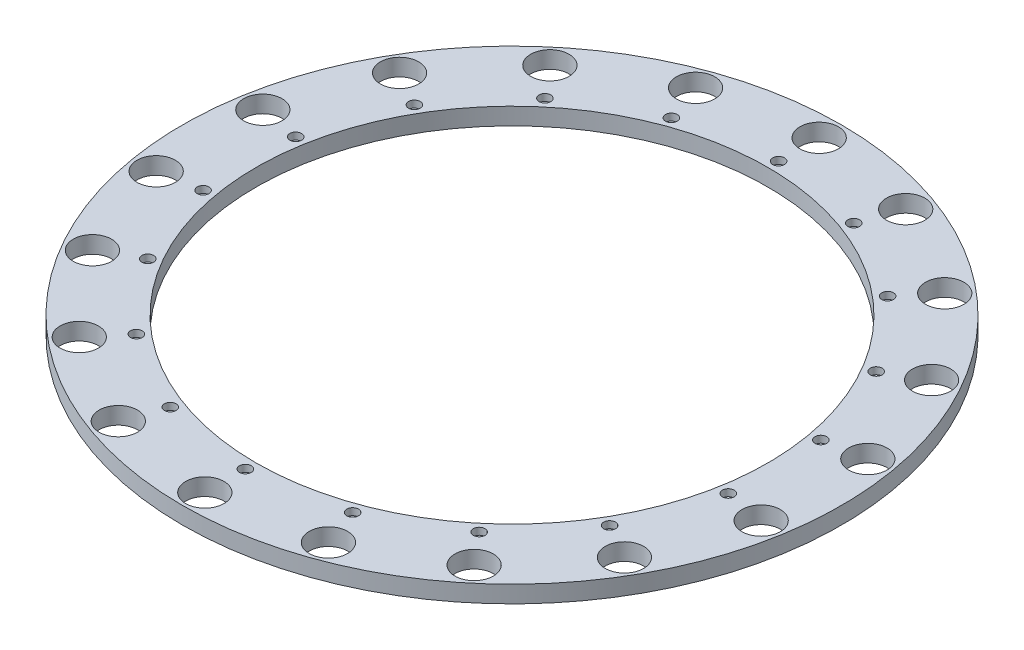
SolidWorks part; units mm, degrees
ref_plane "FRONT" through (0, 0, 0) normal (0, 0, 1) x (1, 0, 0)
ref_plane "TOP" through (0, 0, 0) normal (0, 1, 0) x (1, 0, 0)
ref_plane "RIGHT" through (0, 0, 0) normal (1, 0, 0) x (0, 0, -1)
sketch "HOLDER LAYOUT SKETCH" plane through (0, 0, 0) normal (0, 1, 0) x (1, 0, 0)
  line L0 (0, 0) -> (225.1271, 39.696) construction
  line L1 (0, 0) -> (0, 171.7424) construction
  circle A0 centre (0, 0) radius 228.6 construction
  circle A1 centre (0, 0) radius 198.4375 construction
  circle A2 centre (0, 0) radius 245.2688 construction
  circle A3 centre (0, 0) radius 179.3875 construction
  dimension "D1" = 80
sketch "Sketch7" plane through (0, 0, 0) normal (0, 1, 0) x (1, 0, 0)
  circle A0 centre (0, 0) radius 245.2688
  circle A1 centre (0, 0) radius 179.3875
extrude "Base-Extrude" add sketch "Sketch7" along normal blind 12.7
sketch "Sketch8" plane through (0, 12.7, 0) normal (0, 1, 0) x (-1, 0, 0)
  line L0 (0, 0) -> (-225.1271, -39.696) construction
  line L1 (0, 0) -> (0, -101.5392) construction
  circle A0 centre (-225.1271, -39.696) radius 14.2875
  circle A2 centre (0, 0) radius 179.3875 construction
  dimension "D2" = 28.575
  dimension "D1" = 80
sketch "Sketch10"
  line L0 (46.1326, -47.7795) -> (47.7201, -47.7795) construction
  line L1 (-149.2902, -13.3212) -> (75.8368, -53.0172) construction
  circle A0 centre (-149.2902, -13.3212) radius 198.4375 construction
  point P0 (46.1326, -47.7795)
  dimension "D1" = 1.5875
pattern_circular "# OF PUNCHES" count 18 over 360 about axis through (0, 0, 0) along (0, 1, 0)
extrude "IGLIDE BORE" cut sketch "Sketch8" against normal through all
revolve "Cut-Revolve1" cut sketch "Sketch11" angle 360 about L8
sketch "Sketch11" plane through (195.4228, 0, -34.4583) normal (1, 0, 0) x (0, 0, 1)
  line L0 (0, 0) -> (-3.9878, 0)
  line L2 (-3.9878, 0) -> (-3.9878, -3.175)
  line L3 (-3.9878, -3.175) -> (-2.8067, -3.175)
  line L4 (-2.8067, -3.175) -> (-2.8067, -192.0875)
  line L5 (-2.8067, -192.0875) -> (0, -192.0875)
  line L6 (0, -192.0875) -> (0, 0)
  line L8 (0, 0) -> (0, 7.6635) construction
  dimension "D1" = 2.8067
  dimension "D2" = 3.9878
  dimension "D3" = 3.175
  dimension "D4" = 188.9125
ref_plane "Plane4" through (195.4228, 0, -34.4583) normal (1, 0, 0) x (0, 0, -1)
other "LOCDIA.50001"
sketch "Sketch16" plane through (134.9735, 12.7, 3.779) normal (0, 1, 0) x (-1, 0, 0)
  line L0 (-60.4492, -38.2373) -> (-58.8617, -38.2373)
  point P0 (-60.4492, -38.2373)
  dimension "D1" = 1.5875
ref_plane "Plane5" through (195.4228, 12.7, -34.4583) normal (-1, 0, 0) x (0, 0, 1)
sketch "Sketch17" plane through (195.4228, 12.7, -34.4583) normal (-1, 0, 0) x (0, 0, 1)
  line L0 (0, 0) -> (-4.3656, 0)
  line L2 (-4.3656, 0) -> (-4.3656, -5.1594)
  line L3 (-4.3656, -5.1594) -> (-2.8067, -5.1594)
  line L4 (-2.8067, -5.1594) -> (-2.8067, -208.3594)
  line L5 (-2.8067, -208.3594) -> (0, -208.3594)
  line L6 (0, -208.3594) -> (0, 0)
  line L8 (0, 0) -> (0, 7.6635) construction
  dimension "D1" = 2.8067
  dimension "D2" = 4.3656
  dimension "D3" = 5.1594
  dimension "D4" = 203.2
revolve "Cut-Revolve2" cut sketch "Sketch17" angle 360 about L8
other "CBORE10-OV1" [suppressed]
sketch "Sketch12" plane through (0, 12.7, 0) normal (0, 1, 0) x (-1, 0, 0)
  line L0 (0, 0) -> (-32.253, -182.9157) construction
  line L1 (0, 0) -> (0, -164.5694) construction
  circle A0 centre (-32.253, -182.9157) radius 3.175
  circle A1 centre (0, 0) radius 185.7375 construction
  dimension "D1" = 6.35
  dimension "D3" = 371.475
  dimension "D2" = 10
extrude "CLEARANCE HOLE1" [suppressed] cut sketch "Sketch12" against normal through all
sketch "Sketch13" plane through (0, 12.7, 0) normal (0, 1, 0) x (-1, 0, 0)
  line L0 (0, 0) -> (142.2832, -119.3898) construction
  line L1 (0, 0) -> (-32.253, -182.9157) construction
  circle A0 centre (142.2832, -119.3898) radius 3.175
  circle A1 centre (0, 0) radius 185.7375 construction
  dimension "D1" = 6.35
  dimension "D2" = 60
extrude "CLEARANCE HOLE2" [suppressed] cut sketch "Sketch13" against normal through all
sketch "Sketch14" plane through (0, 12.7, 0) normal (0, 1, 0) x (-1, 0, 0)
  line L0 (0, 0) -> (142.2832, 119.3898) construction
  line L1 (0, 0) -> (-32.253, -182.9157) construction
  circle A0 centre (142.2832, 119.3898) radius 3.175
  circle A1 centre (0, 0) radius 185.7375 construction
  dimension "D1" = 6.35
  dimension "D2" = 140
extrude "CLEARANCE HOLE3" [suppressed] cut sketch "Sketch14" against normal through all
sketch "Sketch15" plane through (0, 12.7, 0) normal (0, 1, 0) x (-1, 0, 0)
  line L0 (0, 0) -> (-142.2832, 119.3898) construction
  line L1 (0, 0) -> (-32.253, -182.9157) construction
  circle A0 centre (-142.2832, 119.3898) radius 3.175
  circle A1 centre (0, 0) radius 185.7375 construction
  dimension "D1" = 6.35
  dimension "D2" = 240
extrude "CLEARANCE HOLE4" [suppressed] cut sketch "Sketch15" against normal through all
pattern_circular "cbore pattern" count 18 every 20 about axis through (0, 0, 0) along (0, 1, 0) of "Cut-Revolve2"
sketch "Sketch18" plane through (0, 0, 0) normal (0, 1, 0) x (1, 0, 0)
  circle A3 centre (0, 0) radius 190.5
  dimension "D1" = 381
extrude "Cut-Extrude2" cut sketch "Sketch18" along normal through all
equation "\"D1@cbore pattern\"=\"D1@# OF PUNCHES\""
equation "\"D2@cbore pattern\"=\"D2@# OF PUNCHES\""
